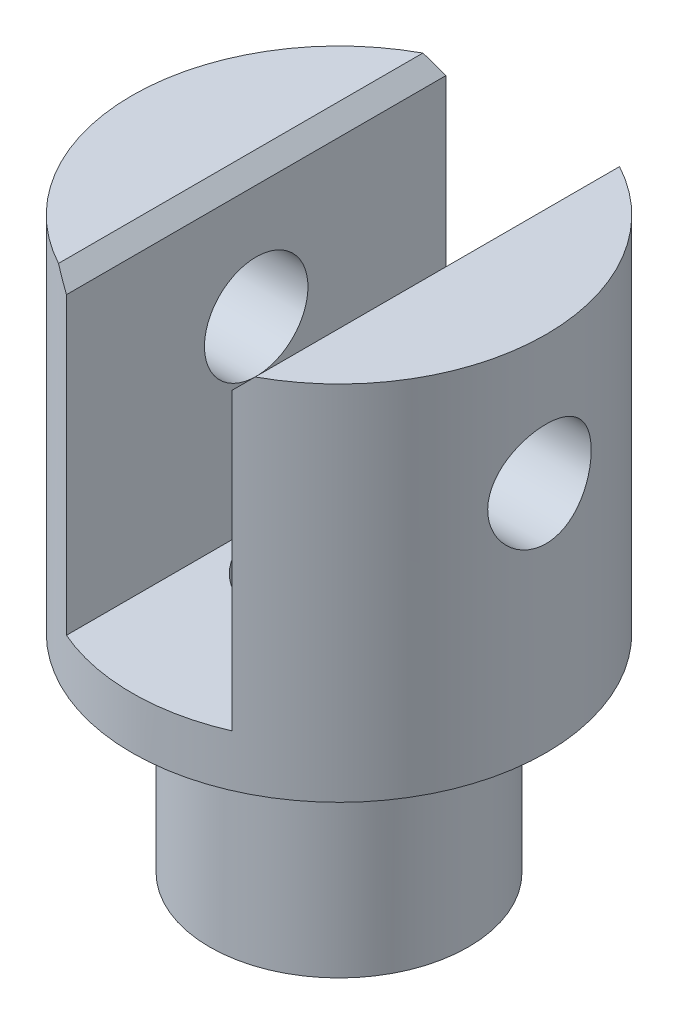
SolidWorks part; units mm, degrees
ref_plane "Front" through (0, 0, 0) normal (0, 0, 1) x (1, 0, 0)
ref_plane "Top" through (0, 0, 0) normal (0, 1, 0) x (1, 0, 0)
ref_plane "Right" through (0, 0, 0) normal (1, 0, 0) x (0, 0, -1)
sketch "Esquisse1" plane through (0, 0, 0) normal (0, 1, 0) x (1, 0, 0)
  circle A0 centre (0, 0) radius 4
  dimension "D1" = 8
extrude "Boss.-Extru.1" add sketch "Esquisse1" along normal blind 7
sketch "Esquisse2" plane through (0, 0, 0) normal (0, -1, 0) x (1, 0, 0)
  circle A0 centre (0, 0) radius 2.5
  dimension "D1" = 5
extrude "Boss.-Extru.2" add sketch "Esquisse2" along normal blind 4
sketch "Esquisse3" plane through (0, 7, 0) normal (0, 1, 0) x (1, 0, 0)
  line L1 (-1.6, 4.9637) -> (1.6, 4.9637)
  line L2 (-1.6, 4.9637) -> (-1.6, -4.9637)
  line L3 (-1.6, -4.9637) -> (1.6, -4.9637)
  line L4 (1.6, 4.9637) -> (1.6, -4.9637)
  line L5 (-1.6, 4.9637) -> (1.6, -4.9637) construction
  line L6 (-1.6, -4.9637) -> (1.6, 4.9637) construction
  point P0 (0, 0)
  dimension "D1" = 3.2
extrude "Enlèv. mat.-Extru.1" cut sketch "Esquisse3" against normal blind 6
hole_wizard "Diamètre du perçage Ø0.15 (0.15)1" positions "Esquisse6" profile "Esquisse5" hole size "Ø0.15" standard "Ansi Metric"
sketch "Esquisse6" plane through (0, -4, 0) normal (0, -1, 0) x (-1, 0, 0)
  point P0 (0, 0)
sketch "Esquisse5" plane through (0, -4, 0) normal (1, 0, 0) x (0, 0, -1)
  line L0 (0, 0) -> (0, 5)
  line L1 (0, 5) -> (1.5, 5)
  line L2 (1.5, 5) -> (1.5, 0)
  line L5 (1.5, 0) -> (0, 0)
  line L11 (0, -6.35) -> (0, 107.95) construction
  dimension "Diamètre du perçage jusqu'au prochain" = 3
  dimension "Profondeur du perçage jusqu'au prochain" = 5
ref_plane "Plan1" through (-4, 0, 0) normal (1, 0, 0) x (0, 0, -1)
hole_wizard "Diamètre du perçage Ø0.15 (0.15)2" positions "Esquisse8" profile "Esquisse7" hole size "Ø0.15" standard "Ansi Metric"
sketch "Esquisse8" plane through (-4, 0, 0) normal (1, 0, 0) x (0, 0, -1)
  line L0 (3.6661, 7) -> (-3.6661, 7) construction
  point P0 (0, 4.5)
  dimension "D1" = 2.5
sketch "Esquisse7" plane through (-4, 4.5, 0) normal (0, 1, 0) x (0, 0, 1)
  line L0 (0, 0) -> (0, 8)
  line L1 (0, 8) -> (1, 8)
  line L2 (1, 8) -> (1, 0)
  line L5 (1, 0) -> (0, 0)
  line L11 (0, -6.35) -> (0, 107.95) construction
  dimension "Diamètre du perçage jusqu'au prochain" = 2
  dimension "Profondeur du perçage jusqu'au prochain" = 8
chamfer "Chanfrein1" distance 0.3 angle 45 2 edges at (-1.6, 7, 0) (1.6, 7, 0)
